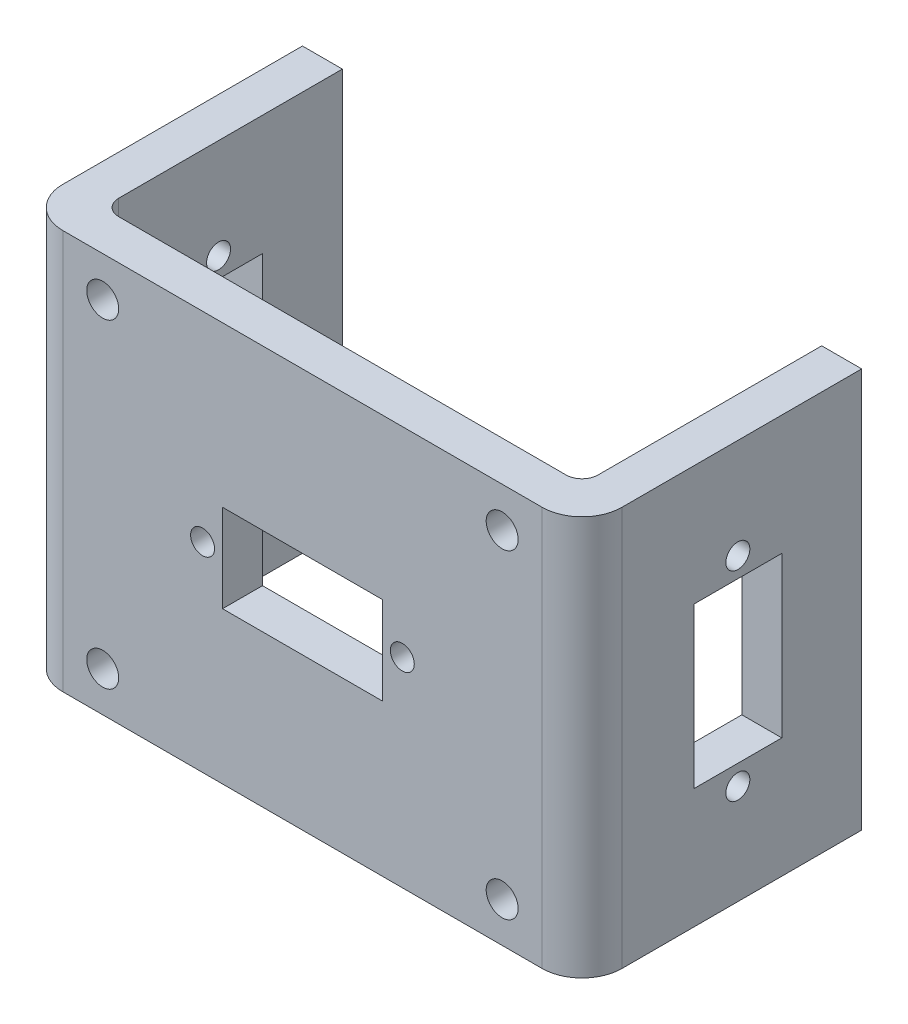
SolidWorks part; units mm, degrees
ref_plane "Plan de face" through (0, 0, 0) normal (0, 0, 1) x (1, 0, 0)
ref_plane "Plan de dessus" through (0, 0, 0) normal (0, 1, 0) x (1, 0, 0)
ref_plane "Plan de droite" through (0, 0, 0) normal (1, 0, 0) x (0, 0, -1)
sketch "Esquisse1" plane through (0, 0, 0) normal (0, 0, 1) x (1, 0, 0)
  line L1 (0, 0) -> (70, 0)
  line L2 (0, 0) -> (0, 50)
  line L3 (0, 50) -> (70, 50)
  line L4 (70, 0) -> (70, 50)
  dimension "D1" = 70
  dimension "D2" = 50
extrude "Extrusion1" add sketch "Esquisse1" along normal blind 35
fillet "Congé1" radius 5 2 edges at (70, 25, 35) (0, 25, 35)
sketch "Esquisse2" plane through (0, 50, 0) normal (0, 1, 0) x (1, 0, 0)
  line L0 (70, 0) -> (0, 0) construction
  line L1 (65, 0) -> (5, 0)
  line L2 (65, 0) -> (65, -28)
  line L3 (63, -30) -> (7, -30)
  line L4 (5, 0) -> (5, -28)
  line L5 (0, -30) -> (0, 0) construction
  line L6 (70, -30) -> (70, 0) construction
  line L7 (65, -35) -> (5, -35) construction
  arc A0 (5, -28) -> (7, -30) centre (7, -28) ccw
  arc A1 (63, -30) -> (65, -28) centre (63, -28) ccw
  dimension "D4" = 2
  dimension "D5" = 2
  dimension "D1" = 5
  dimension "D2" = 5
  dimension "D3" = 5
extrude "Extrusion2" cut sketch "Esquisse2" against normal through all
sketch "Esquisse3" plane through (0, 0, 35) normal (0, 0, 1) x (1, 0, 0)
  line L1 (65, 50) -> (5, 50) construction
  line L2 (65, 0) -> (65, 50) construction
  circle A0 centre (10, 45) radius 2
  circle A1 centre (10, 5) radius 2
  circle A2 centre (60, 5) radius 2
  circle A3 centre (60, 45) radius 2
  dimension "D1" = 4
  dimension "D2" = 4
  dimension "D3" = 4
  dimension "D4" = 4
  dimension "D5" = 50
  dimension "D6" = 50
  dimension "D7" = 40
  dimension "D8" = 40
  dimension "D10" = 5
  dimension "D11" = 5
  dimension "D12" = 5
  dimension "D9" = 5
extrude "Extrusion3" cut sketch "Esquisse3" against normal up to next
sketch "Esquisse4"
sketch "Esquisse5" plane through (0, 0, 0) normal (-1, 0, 0) x (0, 0, 1)
  line L0 (30, 50) -> (0, 50) construction
  line L1 (10, 35) -> (21, 35)
  line L2 (10, 35) -> (10, 15)
  line L3 (10, 15) -> (21, 15)
  line L4 (21, 35) -> (21, 15)
  line L5 (0, 50) -> (0, 0) construction
  circle A0 centre (15.5, 12.5) radius 1.5
  circle A1 centre (15.5, 37.5) radius 1.5
  dimension "D6" = 12.5
  dimension "D7" = 3
  dimension "D8" = 3
  dimension "D9" = 15.5
  dimension "D10" = 15.5
  dimension "D1" = 11
  dimension "D2" = 20
  dimension "D3" = 15
  dimension "D4" = 10
  dimension "D5" = 25
extrude "Extrusion4" cut sketch "Esquisse5" against normal through all
sketch "Esquisse7" plane through (0, 0, 35) normal (0, 0, 1) x (1, 0, 0)
  line L1 (25, 19) -> (45, 19)
  line L2 (25, 19) -> (25, 30)
  line L3 (25, 30) -> (45, 30)
  line L4 (45, 19) -> (45, 30)
  line L6 (65, 50) -> (5, 50) construction
  line L7 (5, 0) -> (5, 50) construction
  circle A0 centre (22.5, 25) radius 1.5
  circle A1 centre (47.5, 25) radius 1.5
  dimension "D3" = 3
  dimension "D4" = 3
  dimension "D5" = 25
  dimension "D7" = 25
  dimension "D8" = 25
  dimension "D10" = 17.5
  dimension "D1" = 20
  dimension "D2" = 11
  dimension "D6" = 20
  dimension "D9" = 20
extrude "Extrusion6" cut sketch "Esquisse7" against normal up to next
